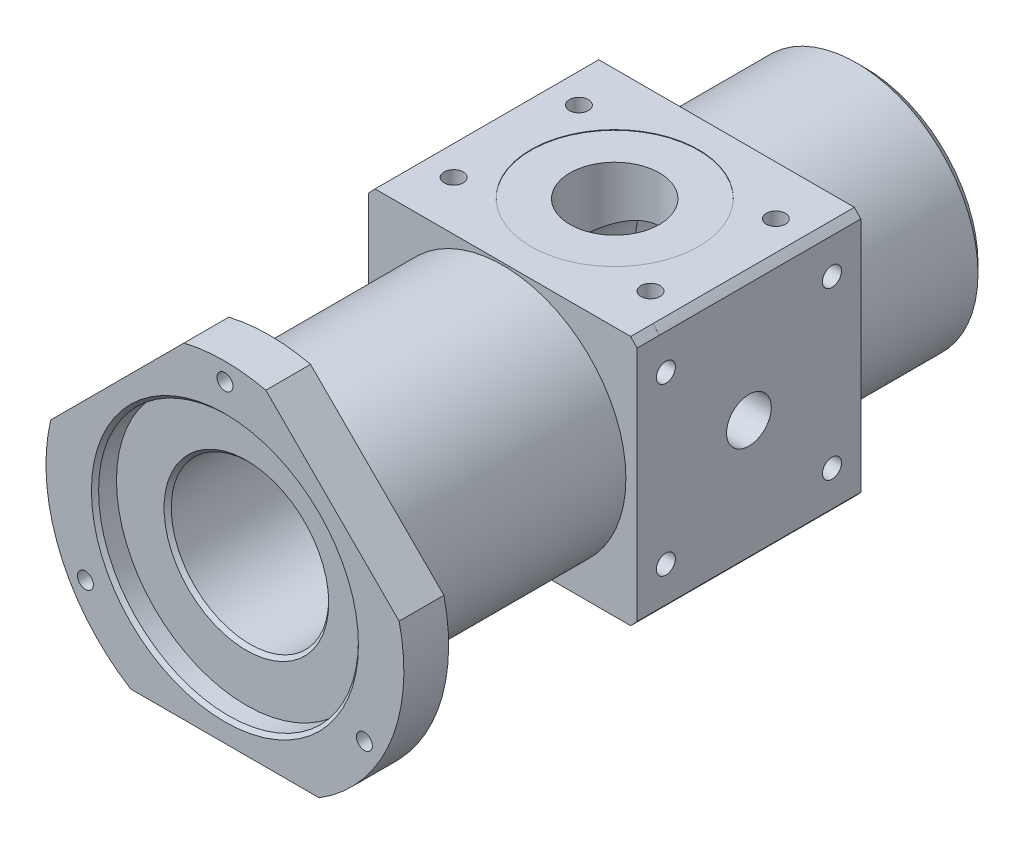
SolidWorks part; units mm, degrees
ref_plane "front_plane" through (0, 0, 0) normal (0, 0, 1) x (1, 0, 0)
ref_plane "top_plane" through (0, 0, 0) normal (0, 1, 0) x (1, 0, 0)
ref_plane "side_plane" through (0, 0, 0) normal (1, 0, 0) x (0, 0, -1)
sketch "Sketch1" plane through (0, 0, 0) normal (0, 0, 1) x (1, 0, 0)
  circle A0 centre (0, 0) radius 25.4
  dimension "D1" = 50.8
extrude "Base-Extrude" add sketch "Sketch1" along normal blind 90.8812
sketch "Sketch2" plane through (0, 0, 90.8812) normal (0, 0, 1) x (1, 0, 0)
  circle A0 centre (0, 0) radius 8.9916
  dimension "D1" = 17.9832
extrude "c_bore_shaft_seal" cut sketch "Sketch2" against normal through all
sketch "Sketch3" plane through (0, 0, 90.8812) normal (0, 0, 1) x (1, 0, 0)
  circle A0 centre (0, 0) radius 11.176
  dimension "D1" = 22.352
extrude "b_bore_coupler" cut sketch "Sketch3" against normal blind 28.2956
sketch "Sketch4" plane through (0, 0, 90.8812) normal (0, 0, 1) x (1, 0, 0)
  circle A0 centre (0, 0) radius 18.4404
  dimension "D1" = 36.8808
extrude "a_bore_motor_mount" cut sketch "Sketch4" against normal blind 3.048
sketch "Sketch5" plane through (0, 0, 0) normal (0, 0, -1) x (-1, 0, 0)
  circle A0 centre (0, 0) radius 12.4968
  dimension "D1" = 24.9936
extrude "f_bore_valve_block" cut sketch "Sketch5" against normal blind 21.463
sketch "Sketch6" plane through (0, 0, 0) normal (0, 0, -1) x (-1, 0, 0)
  circle A0 centre (0, 0) radius 11.1506
  dimension "D1" = 22.3012
extrude "e_bore_cylinder_block" cut sketch "Sketch6" against normal blind 35.56
sketch "Sketch7" plane through (0, 0, 0) normal (0, 0, -1) x (-1, 0, 0)
  circle A0 centre (0, 0) radius 11.0109
  dimension "D1" = 22.0218
extrude "d_bore_swash_bearings" cut sketch "Sketch7" against normal blind 57.0738
sketch "Sketch17" plane through (0, 0, 57.0738) normal (0, 0, -1) x (-1, 0, 0)
  circle A0 centre (0, 0) radius 8.4836
  circle A1 centre (0, 0) radius 9.8814
extrude "Extrude1_shaft_seal_lip" add sketch "Sketch17" against normal blind 0.508
chamfer "Chamfer1_shaft_seal_entry" distance 0.762 angle 15 1 edges at (8.9916, 0, 62.5856)
fillet "Fillet1_bearings" radius 0.254 1 edges at (-11.0109, 0, 57.0738)
chamfer "Chamfer2_cyl_block" distance 0.1397 distance2 0.5334 1 edges at (-11.0109, 0, 35.56)
chamfer "Chamfer3_outlet_id" distance 0.4394 angle 60 1 edges at (-12.4968, 0, 0)
ref_plane "vent_plane" through (0, 17.78, 0) normal (0, 1, 0) x (-1, 0, 0)
sketch "Sketch11" plane through (0, 0, 0) normal (0, 0, -1) x (-1, 0, 0)
  circle A0 centre (0, 0) radius 17.272
  dimension "D1" = 34.544
extrude "outlet_threads" cut sketch "Sketch11" against normal blind 22.86 flip side to cut
chamfer "thread_chamfer" distance 1.27 angle 45 1 edges at (-17.272, 0, 0)
ref_plane "start_bump_out" through (0, 0, 22.86) normal (0, 0, -1) x (-1, 0, 0)
sketch "Sketch18" plane through (0, 17.78, 0) normal (0, 1, 0) x (-1, 0, 0)
  line L0 (0, 0) -> (0, 35.56) construction
  line L1 (0, 90.8812) -> (0, 22.86) construction
  circle A0 centre (0, 35.56) radius 6.35
  dimension "D2" = 12.7
  dimension "D1" = 35.56
extrude "vent_hole" cut sketch "Sketch18" against normal blind 19.05
sketch "Sketch20" plane through (0, 0, 22.86) normal (0, 0, -1) x (-1, 0, 0)
  line L0 (0, 17.78) -> (0, 28.1854) construction
  line L1 (-6.35, 17.78) -> (6.35, 17.78) construction
  line L2 (0, 9.1659) -> (0, 17.78) construction
  line L3 (-26.2833, 17.78) -> (26.2833, 17.78)
  line L4 (26.2833, 17.78) -> (26.2833, 28.1854)
  line L5 (26.2833, 28.1854) -> (-26.2833, 28.1854)
  line L6 (-26.2833, 17.78) -> (-26.2833, 28.1854)
extrude "vent_flat" cut sketch "Sketch20" against normal blind 25.4
sketch "Sketch19" plane through (0, 17.78, 0) normal (0, 1, 0) x (-1, 0, 0)
  line L0 (0, 35.56) -> (13.97, 35.56) construction
  line L1 (0, 90.8812) -> (0, 48.26) construction
  line L2 (13.97, 35.56) -> (13.97, 44.45) construction
  line L3 (0, 35.56) -> (0, 48.26) construction
  line L4 (-18.1392, 48.26) -> (18.1392, 48.26) construction
  circle A0 centre (13.97, 44.45) radius 1.3589
  circle A1 centre (13.97, 26.67) radius 1.3589
  circle A2 centre (-13.97, 26.67) radius 1.3589
  circle A3 centre (-13.97, 44.45) radius 1.3589
  arc A4 (6.3276, 36.0934) -> (-6.3276, 36.0934) centre (0, 35.56) ccw construction
  dimension "D3" = 2.7178
  dimension "D1" = 13.97
  dimension "D2" = 8.89
extrude "vent_mount_holes" [suppressed] cut sketch "Sketch19" against normal blind 10.16
sketch "Sketch33" plane through (0, 17.78, 0) normal (0, 1, 0) x (1, 0, 0)
  circle A0 centre (0, -35.56) radius 11.9063
  dimension "D1" = 23.8125
extrude "top_vent_land" cut sketch "Sketch33" against normal blind 0.0762
ref_plane "end_bump_out" through (0, 0, 48.26) normal (0, 0, -1) x (-1, 0, 0)
sketch "Sketch21" plane through (0, 0, 48.26) normal (0, 0, -1) x (-1, 0, 0)
  circle A0 centre (0, 0) radius 17.4625
  dimension "D1" = 34.925
extrude "mid_body_cut" cut sketch "Sketch21" against normal blind 25.4 flip side to cut
sketch "Sketch22" plane through (0, 0, 90.8812) normal (0, 0, 1) x (1, 0, 0)
  line L0 (0, 0) -> (0, 22.86) construction
  circle A0 centre (0, 0) radius 22.86 construction
  circle A1 centre (0, 22.86) radius 1.1303
  circle A2 centre (19.7973, -11.43) radius 1.1303
  circle A3 centre (-19.7973, -11.43) radius 1.1303
  dimension "D1" = 45.72
  dimension "D2" = 2.2606
extrude "Motor_mount_holes" cut sketch "Sketch22" against normal blind 10.16
chamfer "motor_mount_chamfer" distance 0.508 angle 45 1 edges at (11.176, 0, 87.8332)
chamfer "motor_mount_chamfer2" distance 0.508 angle 45 1 edges at (18.4404, 0, 90.8812)
sketch "Sketch23" plane through (0, 0, 90.8812) normal (0, 0, 1) x (1, 0, 0)
  line L0 (0, 0) -> (0, 22.86) construction
  line L1 (0, 0) -> (15.2664, 15.2664) construction
  line L2 (15.2664, 15.2664) -> (31.7236, -1.1908)
  line L3 (31.7236, -1.1908) -> (38.8826, 5.9682)
  line L4 (38.8826, 5.9682) -> (0, 44.8509)
  line L5 (15.2664, 15.2664) -> (0, 30.5329)
  line L6 (-15.2664, 15.2664) -> (0, 30.5329)
  line L7 (-38.8826, 5.9682) -> (0, 44.8509)
  line L8 (-31.7236, -1.1908) -> (-38.8826, 5.9682)
  line L9 (-15.2664, 15.2664) -> (-31.7236, -1.1908)
  line L10 (0, 0) -> (0, -21.59) construction
  line L11 (-19.5747, -21.59) -> (-19.5747, -28.1335)
  line L12 (-19.5747, -21.59) -> (19.5747, -21.59)
  line L14 (-19.5747, -28.1335) -> (19.5747, -28.1335)
  line L15 (19.5747, -21.59) -> (19.5747, -28.1335)
  point P17 (0, -28.1335)
  dimension "D1" = 45
  dimension "D2" = 21.59
  dimension "D3" = 21.59
extrude "motor_45deg_cuts" cut sketch "Sketch23" against normal blind 10.16
ref_plane "mm_backside" through (0, 0, 84.5312) normal (0, 0, 1) x (1, 0, 0)
sketch "Sketch24" plane through (0, 0, 84.5312) normal (0, 0, 1) x (1, 0, 0)
  circle A0 centre (0, 0) radius 17.4625
  dimension "D1" = 34.925
extrude "backside_cut" cut sketch "Sketch24" against normal blind 20.32 flip side to cut
sketch "Sketch26" plane through (0, 0, 22.86) normal (0, 0, -1) x (-1, 0, 0)
  line L0 (0, 0) -> (19.05, 0) construction
  line L1 (19.05, -22.191) -> (19.05, 22.191)
  line L2 (19.05, 22.191) -> (28.7041, 22.191)
  line L3 (28.7041, 22.191) -> (28.7041, -22.191)
  line L4 (19.05, -22.191) -> (28.7041, -22.191)
  line L5 (0, 0) -> (0, 6.4002) construction
  line L6 (-19.05, -22.191) -> (-28.7041, -22.191)
  line L7 (-28.7041, 22.191) -> (-28.7041, -22.191)
  line L8 (-19.05, 22.191) -> (-28.7041, 22.191)
  line L9 (-19.05, -22.191) -> (-19.05, 22.191)
  point P7 (28.7041, 0)
  point P8 (-28.7041, 0)
  dimension "D1" = 19.05
extrude "side_flats" cut sketch "Sketch26" against normal blind 31.75
sketch "Sketch27" plane through (0, 0, 22.86) normal (0, 0, -1) x (-1, 0, 0)
  line L0 (0, 0) -> (0, -17.78) construction
  line L1 (-22.2775, -17.78) -> (-22.2775, -27.5207)
  line L2 (-22.2775, -17.78) -> (22.2775, -17.78)
  line L4 (-22.2775, -27.5207) -> (22.2775, -27.5207)
  line L5 (22.2775, -17.78) -> (22.2775, -27.5207)
  point P8 (0, -27.5207)
  dimension "D1" = 17.78
extrude "bottom_cut" cut sketch "Sketch27" against normal blind 31.75
sketch "Sketch30" [suppressed] plane through (0, -17.78, 0) normal (0, -1, 0) x (1, 0, 0)
  circle A0 centre (13.97, 26.67) radius 1.1303
  circle A1 centre (-13.97, 26.67) radius 1.1303
  circle A2 centre (13.97, 44.45) radius 1.1303
  circle A3 centre (-13.97, 44.45) radius 1.1303
  dimension "D1" = 2.2606
extrude "bottom_mount_holes" [suppressed] cut sketch "Sketch30" against normal blind 10.16
sketch "Sketch31" plane through (-19.05, 0, 0) normal (-1, 0, 0) x (0, 0, 1)
  line L0 (35.56, 0) -> (35.56, 13.97) construction
  line L1 (35.56, 9.1659) -> (35.56, 17.7038) construction
  line L2 (35.56, 0) -> (43.4647, 0) construction
  line L3 (48.26, 0) -> (22.86, 0) construction
  circle A0 centre (35.56, 13.97) radius 1.1303
  circle A1 centre (35.56, -13.97) radius 1.1303
  dimension "D2" = 2.2606
  dimension "D1" = 13.97
extrude "stbd_side_mount_holes" [suppressed] cut sketch "Sketch31" against normal blind 8.89
sketch "Sketch38" plane through (0, 0, 22.86) normal (0, 0, -1) x (-1, 0, 0)
  line L0 (-18.1392, 17.78) -> (18.1392, 17.78)
  line L1 (19.05, 16.8005) -> (19.05, -16.8005)
  line L2 (18.1392, -17.78) -> (-18.1392, -17.78)
  line L3 (-19.05, -16.8005) -> (-19.05, 16.8005)
  arc A0 (-18.1392, 17.78) -> (-19.05, 16.8005) centre (0, 0) ccw
  arc A1 (-18.1392, 17.78) -> (-19.05, 16.8005) centre (0, 0) ccw construction
  arc A2 (-19.05, -16.8005) -> (-18.1392, -17.78) centre (0, 0) ccw
  arc A3 (18.1392, -17.78) -> (19.05, -16.8005) centre (0, 0) ccw
  arc A4 (19.05, 16.8005) -> (18.1392, 17.78) centre (0, 0) ccw
extrude "Aft_vent_addition" add sketch "Sketch38" along normal blind 3.175 contours M9 M10 M11 M12 M13 M14 M15 M16 M17
sketch "Sketch39" plane through (0, 0, 48.26) normal (0, 0, 1) x (1, 0, 0)
  line L0 (-18.1392, 17.78) -> (18.1392, 17.78)
  line L1 (18.1392, 17.78) -> (19.05, 16.8005)
  line L2 (19.05, 16.8005) -> (19.05, -16.8005)
  line L3 (18.1392, -17.78) -> (-18.1392, -17.78)
  line L4 (-19.05, -16.8005) -> (-19.05, 16.8005)
  arc A0 (-18.1392, 17.78) -> (-19.05, 16.8005) centre (0, 0) ccw
  arc A1 (-18.1392, 17.78) -> (-19.05, 16.8005) centre (0, 0) ccw construction
  arc A2 (-19.05, -16.8005) -> (-18.1392, -17.78) centre (0, 0) ccw
  arc A3 (18.1392, -17.78) -> (19.05, -16.8005) centre (0, 0) ccw
  arc A4 (19.05, 16.8005) -> (18.1392, 17.78) centre (0, 0) ccw
extrude "fwd_vent_addition" add sketch "Sketch39" along normal blind 3.175 contours L1 M5 M7 M8 M9 M2 M3 M4 M1
sketch "Sketch35" plane through (19.05, 0, 0) normal (1, 0, 0) x (0, 0, -1)
  circle A0 centre (-35.56, 0) radius 3.175
  dimension "D1" = 6.35
extrude "port_inlet_-011_o-ring" cut sketch "Sketch35" against normal blind 19.05
hole_wizard "#6-32 inlet_bolt_circle" positions "3DSketch1" profile "Sketch36" tap size "#6-32" standard "Ansi Inch"
sketch3d "3DSketch1"
  line L5 (19.05, 0, 35.56) -> (19.05, -11.7866, 47.3466) construction
  line L8 (19.05, 0, 35.56) -> (19.05, 11.7866, 23.7734) construction
  line L9 (19.05, 0, 35.56) -> (19.05, 11.7866, 47.3466) construction
  line L12 (19.05, 0, 35.56) -> (19.05, -11.7866, 23.7734) construction
  line L13 (19.05, 0, 35.56) -> (19.05, 16.6687, 35.56) construction
  circle A0 centre (19.05, 0, 35.56) radius 16.6687 construction
  circle A3 centre (19.05, 0, 35.56) radius 3.175 construction
  point P2 (19.05, 11.7866, 47.3466)
  point P8 (19.05, -11.7866, 47.3466)
  point P10 (19.05, 11.7866, 23.7734)
  point P17 (35.7187, 0, 35.56)
  point P34 (19.05, -11.7866, 23.7734)
  point P69 (22.225, 0, 35.56)
  dimension "D1" = 33.3375
  dimension "D2" = 90
  dimension "D4" = 90
  dimension "D3" = 90
  dimension "D5" = 45
sketch "Sketch36" plane through (19.05, 11.7866, 47.3466) normal (0, 1, 0) x (0, 0, -1)
  line L0 (0, 0) -> (0, 10.3377)
  line L1 (0, 10.3377) -> (1.3525, 9.525)
  line L2 (1.3525, 9.525) -> (1.3525, 0)
  line L5 (1.3525, 0) -> (0, 0)
  line L10 (0, 10.3377) -> (-1.3526, 9.525) construction
  line L11 (0, -6.35) -> (0, 107.95) construction
  dimension "Tap Drill Dia." = 2.7051
  dimension "Tap Drill Depth" = 9.525
  dimension "Drill Angle" = 118
hole_wizard "#6-32 Tapped Hole1" positions "3DSketch2" profile "Sketch40" tap size "#6-32" standard "Ansi Inch"
sketch3d "3DSketch2"
  point P9 (13.97, 17.78, 26.67)
  point P19 (-13.97, 17.78, 26.67)
  point P21 (-13.97, 17.78, 44.45)
  point P23 (13.97, 17.78, 44.45)
sketch "Sketch40" plane through (13.97, 17.78, 26.67) normal (1, 0, 0) x (0, 0, 1)
  line L0 (0, 0) -> (0, 10.3377)
  line L1 (0, 10.3377) -> (1.3525, 9.525)
  line L2 (1.3525, 9.525) -> (1.3525, 0)
  line L5 (1.3525, 0) -> (0, 0)
  line L10 (0, 10.3377) -> (-1.3526, 9.525) construction
  line L11 (0, -6.35) -> (0, 107.95) construction
  dimension "Tap Drill Dia." = 2.7051
  dimension "Tap Drill Depth" = 9.525
  dimension "Drill Angle" = 118
hole_wizard "#4-40 Tapped Hole2" positions "Sketch42" profile "Sketch41" tap size "#4-40" standard "Ansi Inch"
sketch "Sketch42" plane through (0, -17.78, 0) normal (0, -1, 0) x (1, 0, 0)
  point P0 (-13.97, 44.45)
  point P1 (13.97, 44.45)
  point P4 (13.97, 26.67)
  point P7 (-13.97, 26.67)
sketch "Sketch41" plane through (-13.97, -17.78, 44.45) normal (1, 0, 0) x (0, 0, -1)
  line L0 (0, 0) -> (0, 8.6167)
  line L1 (0, 8.6167) -> (1.1303, 7.9375)
  line L2 (1.1303, 7.9375) -> (1.1303, 0)
  line L5 (1.1303, 0) -> (0, 0)
  line L10 (0, 8.6167) -> (-1.1303, 7.9375) construction
  line L11 (0, -6.35) -> (0, 107.95) construction
  dimension "Tap Drill Dia." = 2.2606
  dimension "Tap Drill Depth" = 7.9375
  dimension "Drill Angle" = 118
